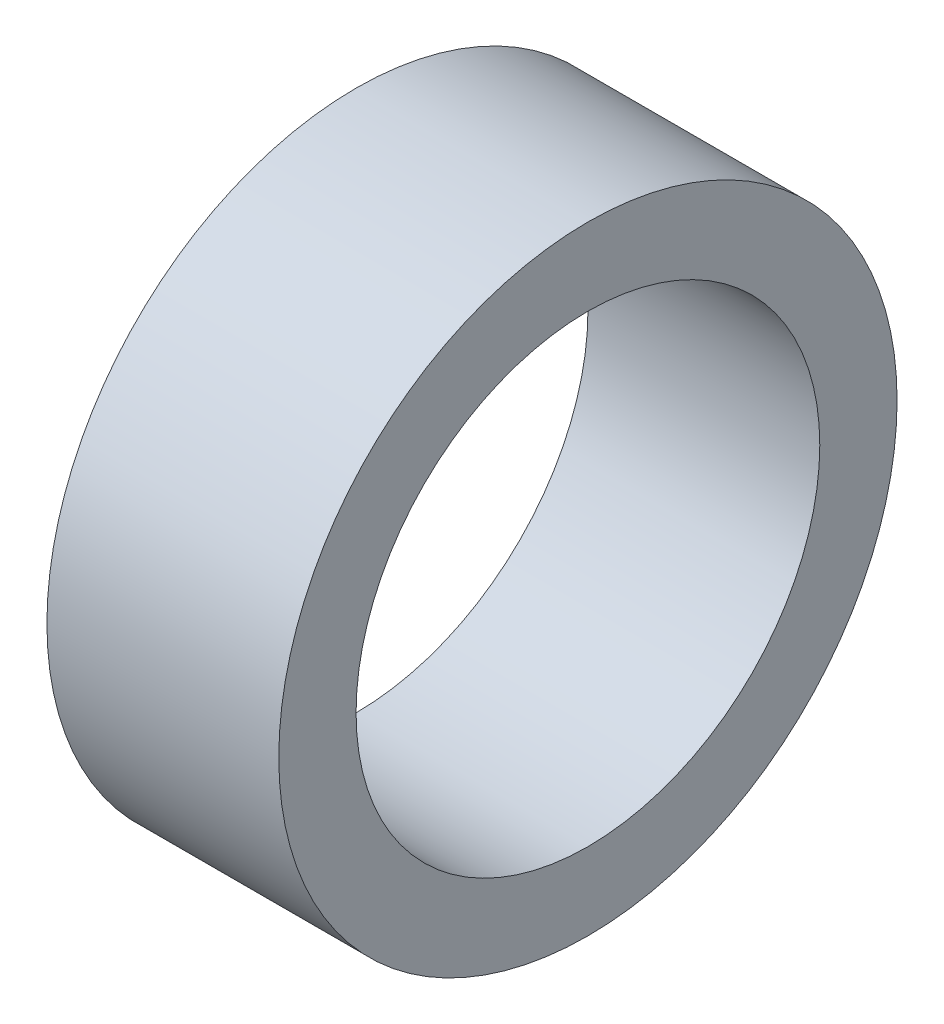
SolidWorks part; units mm, degrees
ref_plane "Alzado" through (0, 0, 0) normal (0, 0, 1) x (1, 0, 0)
ref_plane "Planta" through (0, 0, 0) normal (0, 1, 0) x (1, 0, 0)
ref_plane "Vista lateral" through (0, 0, 0) normal (1, 0, 0) x (0, 0, -1)
sketch "Croquis1" plane through (0, 0, 0) normal (1, 0, 0) x (0, 0, -1)
  circle A0 centre (0, 0) radius 20
  circle A1 centre (0, 0) radius 15
  dimension "D1" = 40
  dimension "D2" = 30
extrude "Saliente-Extruir1" add sketch "Croquis1" along normal blind 15
